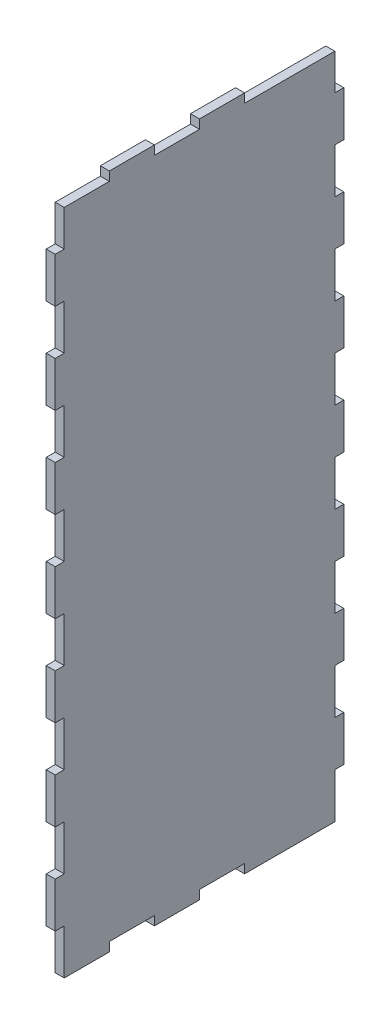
SolidWorks part; units mm, degrees
ref_plane "Front Plane" through (0, 0, 0) normal (0, 0, 1) x (1, 0, 0)
ref_plane "Top Plane" through (0, 0, 0) normal (0, 1, 0) x (1, 0, 0)
ref_plane "Right Plane" through (0, 0, 0) normal (1, 0, 0) x (0, 0, -1)
sketch "Sketch1" plane through (0, 0, 0) normal (0, 0, 1) x (1, 0, 0)
  line L1 (75, -75) -> (73, -75)
  line L2 (75, -75) -> (75, 73)
  line L3 (75, 73) -> (73, 73)
  line L4 (73, -75) -> (73, 73)
extrude "Boss-Extrude1" add sketch "Sketch1" along normal blind 60
sketch "Sketch2" plane through (0, -75, 0) normal (0, -1, 0) x (1, 0, 0)
  line L0 (73, 60) -> (73, 0) construction
  line L1 (73, 50) -> (75, 50)
  line L2 (73, 50) -> (73, 40)
  line L3 (73, 40) -> (75, 40)
  line L4 (75, 50) -> (75, 40)
  line L5 (75, 60) -> (75, 0) construction
  line L6 (73, 60) -> (75, 60) construction
  dimension "D1" = 10
  dimension "D2" = 10
extrude "Cut-Extrude1" cut sketch "Sketch2" against normal blind 2
pattern_linear "LPattern1" count 2 spacing 20 along (0, 0, -1) of "Cut-Extrude1"
sketch "Sketch3" plane through (0, 73, 0) normal (0, 1, 0) x (1, 0, 0)
  line L0 (75, -30) -> (73, -30) construction
  line L1 (73, -50) -> (73, -40) construction
  line L2 (75, -40) -> (75, -50) construction
  line L3 (73, -40) -> (75, -40) construction
  line L4 (75, -50) -> (73, -50) construction
  line L5 (73, -20) -> (75, -20) construction
  line L6 (73, -30) -> (73, -20) construction
  line L7 (75, -20) -> (75, -30) construction
  line L8 (75, -30) -> (73, -30)
  line L9 (73, -20) -> (75, -20)
  line L10 (73, -30) -> (73, -20)
  line L11 (75, -20) -> (75, -30)
  line L12 (75, -50) -> (73, -50)
  line L13 (73, -40) -> (75, -40)
  line L14 (75, -40) -> (75, -50)
  line L15 (73, -50) -> (73, -40)
extrude "Boss-Extrude2" add sketch "Sketch3" along normal blind 2
sketch "Sketch4" plane through (0, 0, 60) normal (0, 0, 1) x (1, 0, 0)
  line L0 (73, 73) -> (73, -75) construction
  line L1 (73, -65) -> (75, -65)
  line L2 (73, -65) -> (73, -55)
  line L3 (73, -55) -> (75, -55)
  line L4 (75, -65) -> (75, -55)
  line L5 (75, -75) -> (75, 73) construction
  line L6 (73, -75) -> (75, -75) construction
  dimension "D1" = 10
  dimension "D2" = 10
extrude "Boss-Extrude3" add sketch "Sketch4" along normal blind 2
pattern_linear "LPattern2" count 7 spacing 20 along (0, 1, 0) of "Boss-Extrude3"
sketch "Sketch5" plane through (75, 0, 0) normal (1, 0, 0) x (0, 0, -1)
  line L0 (-62, -5) -> (0, -5) construction
  line L1 (0, -75) -> (0, 73) construction
  line L2 (-31, -5) -> (-31, -30.5567) construction
sketch "Sketch6" plane through (0, 0, 0) normal (0, 0, -1) x (-1, 0, 0)
  line L0 (-73, -55) -> (-73, -65) construction
  line L1 (-73, -65) -> (-75, -65) construction
  line L2 (-75, -65) -> (-75, -55) construction
  line L3 (-75, -55) -> (-73, -55) construction
  line L4 (-73, -35) -> (-73, -45) construction
  line L5 (-73, -45) -> (-75, -45) construction
  line L6 (-75, -45) -> (-75, -35) construction
  line L7 (-75, -35) -> (-73, -35) construction
  line L8 (-73, -15) -> (-73, -25) construction
  line L9 (-73, -25) -> (-75, -25) construction
  line L10 (-75, -25) -> (-75, -15) construction
  line L11 (-75, -15) -> (-73, -15) construction
  line L12 (-73, 5) -> (-73, -5) construction
  line L13 (-73, -5) -> (-75, -5) construction
  line L14 (-75, -5) -> (-75, 5) construction
  line L15 (-75, 5) -> (-73, 5) construction
  line L16 (-73, 25) -> (-73, 15) construction
  line L17 (-73, 15) -> (-75, 15) construction
  line L18 (-75, 15) -> (-75, 25) construction
  line L19 (-75, 25) -> (-73, 25) construction
  line L20 (-73, 45) -> (-73, 35) construction
  line L21 (-73, 35) -> (-75, 35) construction
  line L22 (-75, 35) -> (-75, 45) construction
  line L23 (-75, 45) -> (-73, 45) construction
  line L24 (-73, 65) -> (-73, 55) construction
  line L25 (-73, 55) -> (-75, 55) construction
  line L26 (-75, 55) -> (-75, 65) construction
  line L27 (-75, 65) -> (-73, 65) construction
  line L28 (-73, -55) -> (-73, -65)
  line L29 (-73, -65) -> (-75, -65)
  line L30 (-75, -65) -> (-75, -55)
  line L31 (-75, -55) -> (-73, -55)
  line L32 (-73, -35) -> (-73, -45)
  line L33 (-73, -45) -> (-75, -45)
  line L34 (-75, -45) -> (-75, -35)
  line L35 (-75, -35) -> (-73, -35)
  line L36 (-73, -15) -> (-73, -25)
  line L37 (-73, -25) -> (-75, -25)
  line L38 (-75, -25) -> (-75, -15)
  line L39 (-75, -15) -> (-73, -15)
  line L40 (-73, 5) -> (-73, -5)
  line L41 (-73, -5) -> (-75, -5)
  line L42 (-75, -5) -> (-75, 5)
  line L43 (-75, 5) -> (-73, 5)
  line L44 (-73, 25) -> (-73, 15)
  line L45 (-73, 15) -> (-75, 15)
  line L46 (-75, 15) -> (-75, 25)
  line L47 (-75, 25) -> (-73, 25)
  line L48 (-73, 45) -> (-73, 35)
  line L49 (-73, 35) -> (-75, 35)
  line L50 (-75, 35) -> (-75, 45)
  line L51 (-75, 45) -> (-73, 45)
  line L52 (-73, 65) -> (-73, 55)
  line L53 (-73, 55) -> (-75, 55)
  line L54 (-75, 55) -> (-75, 65)
  line L55 (-75, 65) -> (-73, 65)
extrude "Boss-Extrude4" add sketch "Sketch6" along normal blind 2
equation "\"anch\" = 2"
equation "\"alt\" = 100"
equation "\"pilanch\" = 100"
equation "\"pilalt\" = 250"
equation "\"D1@Sketch1\"=\"anch\""
equation "\"bodyHeigh\" = 60"
equation "\"D1@Boss-Extrude1\"=\"bodyHeigh\""
equation "\"D1@Cut-Extrude1\"=\"anch\""
equation "\"D1@Boss-Extrude2\"=\"anch\""
equation "\"D1@Boss-Extrude3\"=\"anch\""
equation "\"D1@Boss-Extrude4\"=\"anch\""
equation "\"dorsalFinHeigh\" = 400"
